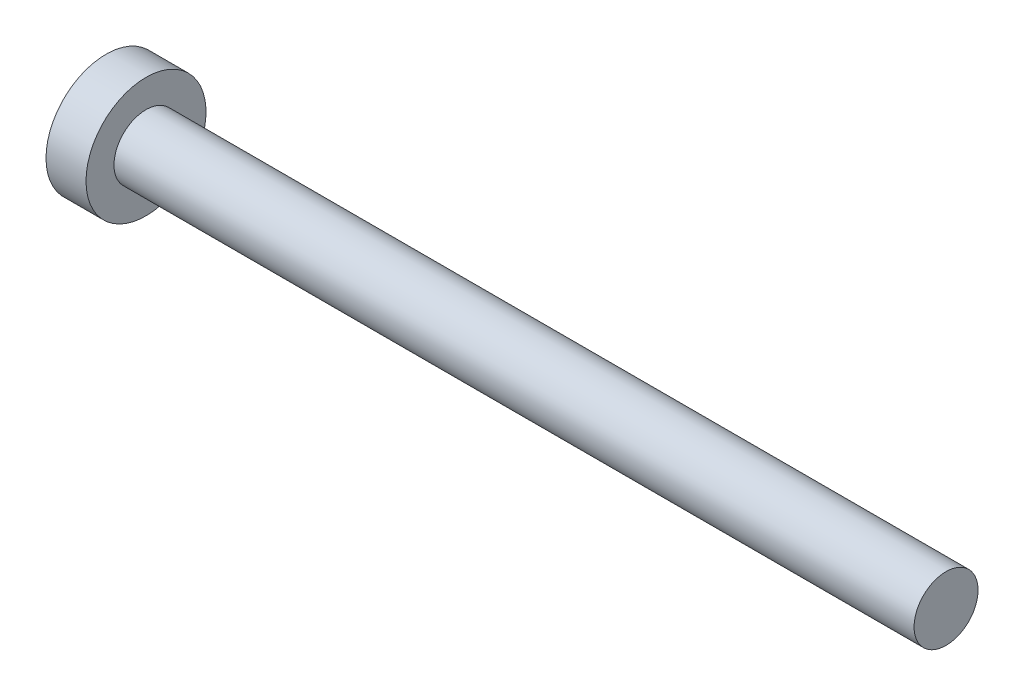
SolidWorks part; units mm, degrees
ref_plane "Plan de face" through (0, 0, 0) normal (0, 0, 1) x (1, 0, 0)
ref_plane "Plan de dessus" through (0, 0, 0) normal (0, 1, 0) x (1, 0, 0)
ref_plane "Plan de droite" through (0, 0, 0) normal (1, 0, 0) x (0, 0, -1)
sketch "Esquisse1" plane through (0, 0, 0) normal (0, 0, 1) x (1, 0, 0)
  line L0 (-59.2736, 0) -> (68.9103, 0) construction
  line L1 (-41.8357, 0) -> (-41.8357, 15)
  line L2 (-41.8357, 15) -> (-31.8357, 15)
  line L3 (-31.8357, 15) -> (-31.8357, 8)
  line L4 (-31.8357, 8) -> (168.1643, 8)
  line L5 (168.1643, 8) -> (168.1643, 0)
  line L6 (-41.8357, 0) -> (168.1643, 0)
  dimension "D1" = 15
  dimension "D2" = 16
  dimension "D3" = 10
  dimension "D4" = 200
revolve "Révolution1" add sketch "Esquisse1" angle 360 about L0
